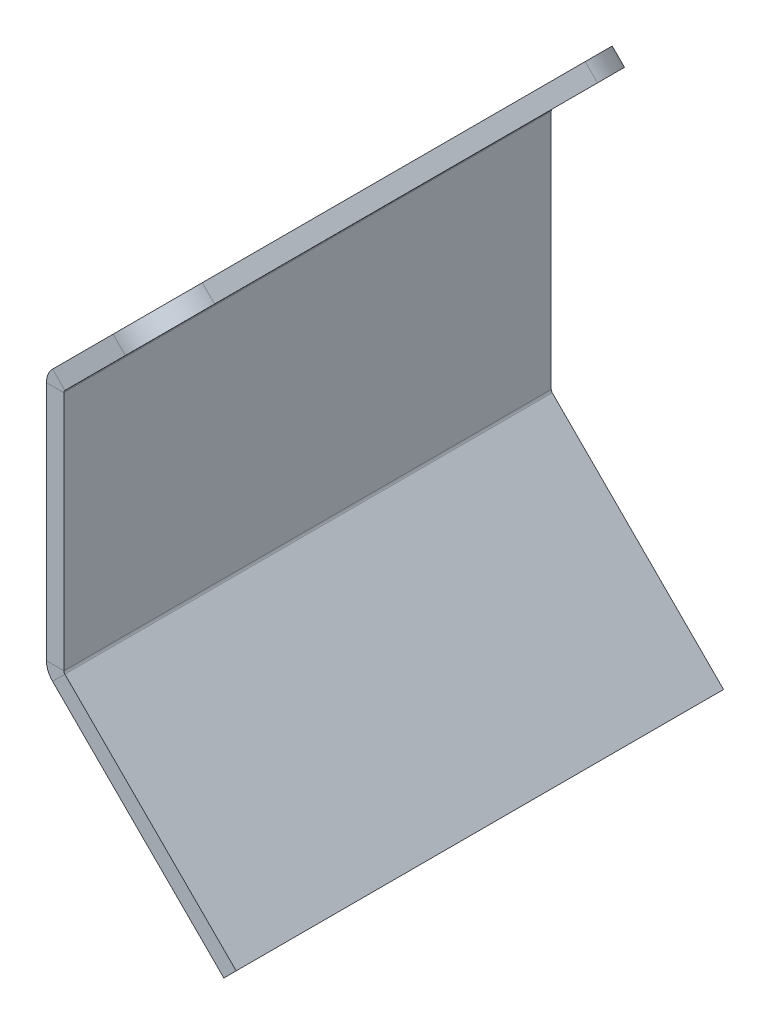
SolidWorks part; units mm, degrees
ref_plane "Plan de face" through (0, 0, 0) normal (0, 0, 1) x (1, 0, 0)
ref_plane "Plan de dessus" through (0, 0, 0) normal (0, 1, 0) x (1, 0, 0)
ref_plane "Plan de droite" through (0, 0, 0) normal (1, 0, 0) x (0, 0, -1)
sketch "Esquisse1" plane through (0, 0, 0) normal (0, 0, 1) x (1, 0, 0)
  line L0 (28.2843, 28.2843) -> (0.2929, 0.2929)
  line L1 (0, -0.4142) -> (0, -69.5858)
  line L2 (0.2929, -70.2929) -> (49.4975, -119.4975)
  arc A0 (0, -0.4142) -> (0.2929, 0.2929) centre (1, -0.4142) cw
  arc A1 (0, -69.5858) -> (0.2929, -70.2929) centre (1, -69.5858) ccw
  point P7 (0, 0)
  point P10 (0, -70)
  dimension "D5" = 1
  dimension "D1" = 45
  dimension "D2" = 40
  dimension "D3" = 70
  dimension "D4" = 70
extrude "Extru.-Mince1" add sketch "Esquisse1" along normal mid plane 140 thin
sheet metal parameters "Tôlerie 1" parameters "D1"=0.7366
bend "Pli issu d'un arrondi2" bend radius 1 bend angle 45 parameters "D5"=1
flatten bends "Dépliage 1" parameters "D1"=0
sketch "Esquisse-Angle1" plane through (0, 0, 0) normal (0.7071, -0.7071, 0) x (0.7071, 0.7071, 0)
  line L0 (-0.9602, 70) -> (-0.9602, -70) construction
  line L1 (-72.8807, 70) -> (-72.8807, -70) construction
bend "Pli issu d'un arrondi1" bend radius 1 bend angle 45 parameters "D5"=2
process bends "Pliage 1" parameters "D1"=0
sketch "Esquisse-Plate1" plane through (0, 0, 0) normal (0.7071, -0.7071, 0) x (0.7071, 0.7071, 0)
fillet "Congé1" radius 15 2 edges at (26.5165, 30.052, -70) (26.5165, 30.052, 70)
flat pattern "Etat déplié1"
sketch "Lignes de pliage1" plane through (0, 0, 0) normal (0.7071, -0.7071, 0) x (0.7071, 0.7071, 0)
  line L0 (-72.8807, -70) -> (-72.8807, 70) construction
  line L1 (-0.9602, -70) -> (-0.9602, 70) construction
  line L2 (-72.8807, -70) -> (-72.8807, 70) construction
  line L3 (-0.9602, -70) -> (-0.9602, 70) construction
bend of the flat pattern "Dépliage-<Pli issu d'un arrondi1>1"
bend of the flat pattern "Dépliage-<Pli issu d'un arrondi2>1"
